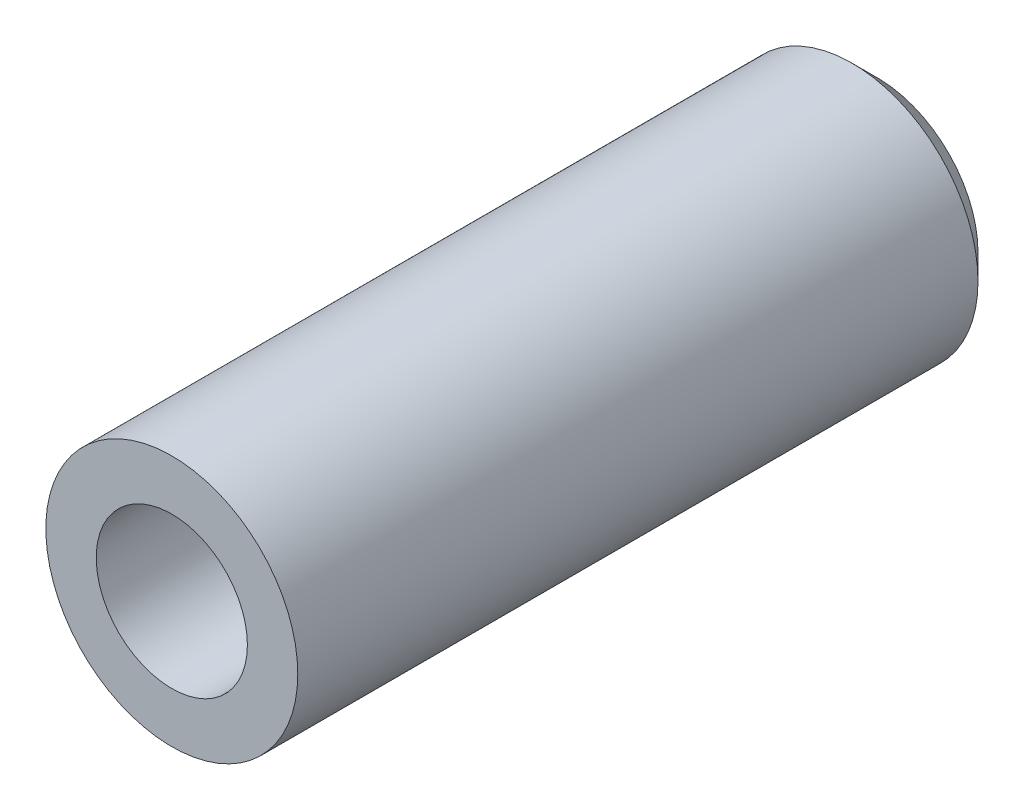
SolidWorks part; units mm, degrees
ref_plane "Plan de face" through (0, 0, 0) normal (0, 0, 1) x (1, 0, 0)
ref_plane "Plan de dessus" through (0, 0, 0) normal (0, 1, 0) x (1, 0, 0)
ref_plane "Plan de droite" through (0, 0, 0) normal (1, 0, 0) x (0, 0, -1)
sketch "Esquisse1" plane through (0, 0, 0) normal (0, 0, 1) x (1, 0, 0)
  circle A0 centre (38.3796, 299.3938) radius 5
extrude "Boss.-Extru.1" add sketch "Esquisse1" along normal blind 28
sketch "Esquisse2" plane through (0, 0, 28) normal (0, 0, 1) x (1, 0, 0)
  circle A0 centre (38.3796, 299.3938) radius 3
  dimension "D1" = 6
extrude "Enlèv. mat.-Extru.1" cut sketch "Esquisse2" against normal blind 13
sketch "Esquisse3" plane through (0, 0, 15) normal (0, 0, 1) x (1, 0, 0)
  circle A0 centre (38.3796, 299.3938) radius 1
  dimension "D1" = 2
extrude "Enlèv. mat.-Extru.2" cut sketch "Esquisse3" against normal through all
chamfer "Chanfrein1" distance 1 angle 45 1 edges at (43.3796, 299.3938, 0)
